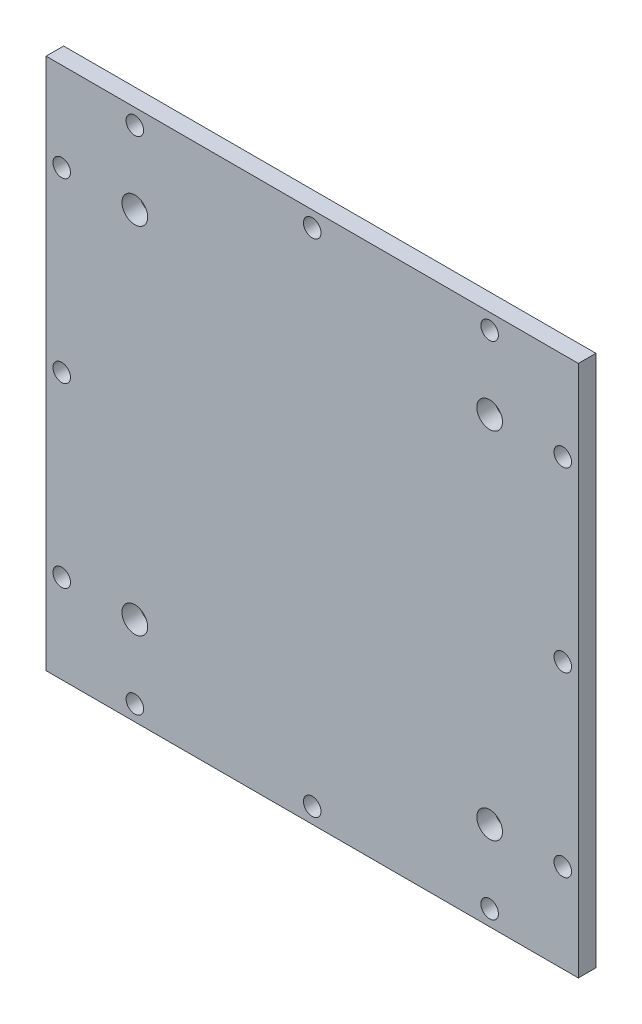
SolidWorks part; units mm, degrees
ref_plane "Front Plane" through (0, 0, 0) normal (0, 0, 1) x (1, 0, 0)
ref_plane "Top Plane" through (0, 0, 0) normal (0, 1, 0) x (1, 0, 0)
ref_plane "Right Plane" through (0, 0, 0) normal (1, 0, 0) x (0, 0, -1)
sketch "Sketch2" plane through (0, 0, 0) normal (0, 0, 1) x (1, 0, 0)
  line L1 (-68.25, 68.25) -> (68.25, 68.25)
  line L2 (-68.25, 68.25) -> (-68.25, -68.25)
  line L3 (-68.25, -68.25) -> (68.25, -68.25)
  line L4 (68.25, 68.25) -> (68.25, -68.25)
  point P4 (0, -68.25)
  point P6 (-68.25, 0)
  dimension "D1" = 136.5
  dimension "D2" = 136.5
extrude "Boss-Extrude1" add sketch "Sketch2" along normal blind 4.5
hole_wizard "M4 Clearance Hole1" positions "Sketch3" profile "Sketch5" hole size "M4" standard "ANSI Metric"
sketch "Sketch3" plane through (0, 0, 4.5) normal (0, 0, 1) x (1, 0, 0)
  line L3 (0, 0) -> (0, 71.7866) construction
  line L4 (68.25, 68.25) -> (-68.25, 68.25) construction
  line L5 (0, 0) -> (-76.5907, 0) construction
  point P0 (-64.25, 45.5)
  point P2 (-64.25, 0)
  point P4 (-64.25, -45.5)
  point P23 (-45.5, 64.25)
  point P25 (0, 64.25)
  point P27 (45.5, 64.25)
  point P33 (64.25, -45.5)
  point P34 (64.25, 0)
  point P35 (64.25, 45.5)
  point P36 (45.5, -64.25)
  point P37 (0, -64.25)
  point P38 (-45.5, -64.25)
  dimension "D1" = 64.25
  dimension "D2" = 45.5
  dimension "D3" = 4
  dimension "D4" = 45.5
  dimension "D5" = 128.5
  dimension "D6" = 128.5
sketch "Sketch5" plane through (-64.25, 45.5, 4.5) normal (1, 0, 0) x (0, -1, 0)
  line L0 (0, 0) -> (0, 4.5)
  line L1 (0, 4.5) -> (2.25, 4.5)
  line L2 (2.25, 4.5) -> (2.25, 0)
  line L5 (2.25, 0) -> (0, 0)
  line L11 (0, -6.35) -> (0, 107.95) construction
  dimension "Thru Hole Dia." = 4.5
  dimension "Thru Hole Depth" = 4.5
hole_wizard "M6 Clearance Hole1" positions "Sketch6" profile "Sketch7" hole size "M6" standard "ANSI Metric"
sketch "Sketch6" plane through (0, 0, 4.5) normal (0, 0, 1) x (1, 0, 0)
  line L4 (0, 0) -> (0, 71.4232) construction
  line L5 (0, 0) -> (-93.8577, 0) construction
  line L7 (0, 0) -> (-76.5907, 0) construction
  point P0 (-45.5, 45.5)
  point P2 (-45.5, -45.5)
  point P20 (45.5, -45.5)
  point P21 (45.5, 45.5)
  dimension "D1" = 45.5
sketch "Sketch7" plane through (-45.5, 45.5, 4.5) normal (1, 0, 0) x (0, -1, 0)
  line L0 (0, 0) -> (0, 4.5)
  line L1 (0, 4.5) -> (3.3, 4.5)
  line L2 (3.3, 4.5) -> (3.3, 0)
  line L5 (3.3, 0) -> (0, 0)
  line L11 (0, -6.35) -> (0, 107.95) construction
  dimension "Thru Hole Dia." = 6.6
  dimension "Thru Hole Depth" = 4.5
